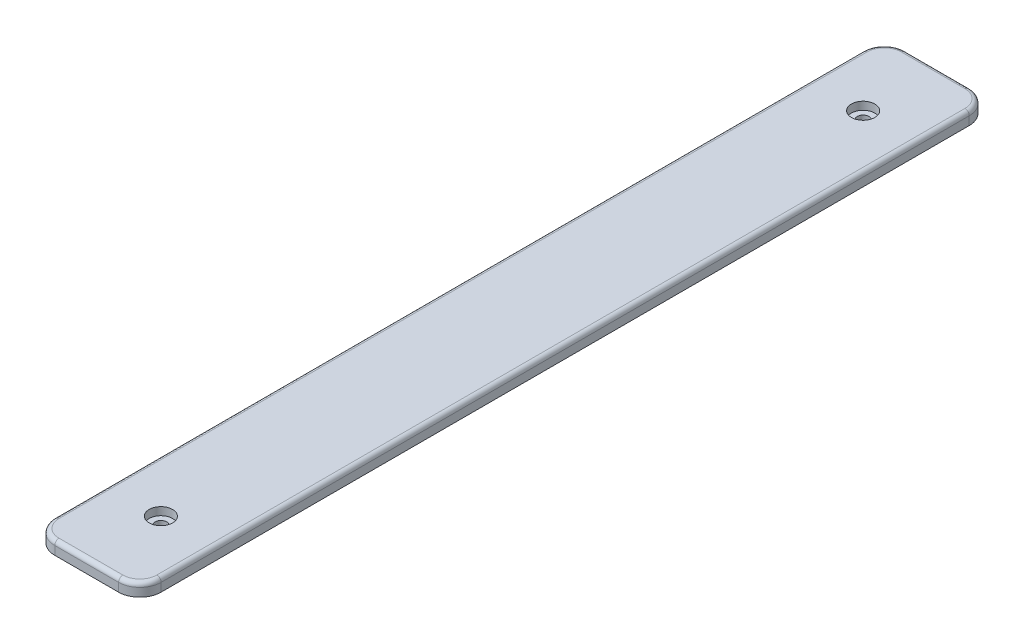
SolidWorks part; units mm, degrees
ref_plane "Front Plane" through (0, 0, 0) normal (0, 0, 1) x (1, 0, 0)
ref_plane "Top Plane" through (0, 0, 0) normal (0, 1, 0) x (1, 0, 0)
ref_plane "Right Plane" through (0, 0, 0) normal (1, 0, 0) x (0, 0, -1)
sketch "Sketch1" plane through (0, 0, 0) normal (0, 1, 0) x (1, 0, 0)
  line L0 (-25, -200) -> (25, 200) construction
  line L1 (-25, 200) -> (25, 200)
  line L2 (-25, 200) -> (-25, -200)
  line L3 (-25, -200) -> (25, -200)
  line L4 (25, 200) -> (25, -200)
  dimension "D1" = 400
  dimension "D2" = 50
extrude "Extrude1" add sketch "Sketch1" along normal blind 6
hole_wizard "CBORE for M5 Pan Head Machine Screw1" positions "Sketch3" profile "Sketch2" counterbore size "M5" standard "Ansi Metric"
sketch "Sketch3" plane through (0, 6, 0) normal (0, 1, 0) x (-1, 0, 0)
  line L0 (0, 200) -> (0, -200) construction
  line L1 (25, 200) -> (-25, 200) construction
  line L2 (-25, -200) -> (25, -200) construction
  line L3 (0, 0) -> (50.3155, 0) construction
  point P0 (0, 165.1)
  point P1 (0, -165.1)
  dimension "D1" = 330.2
sketch "Sketch2" plane through (0, 6, 165.1) normal (1, 0, 0) x (0, 0, 1)
  line L0 (0, 0) -> (0, 6)
  line L1 (0, 6) -> (2.75, 6)
  line L3 (2.75, 6) -> (2.75, 3.7)
  line L4 (2.75, 3.7) -> (5.5, 3.7)
  line L5 (5.5, 3.7) -> (5.5, 0)
  line L7 (5.5, 0) -> (0, 0)
  line L11 (0, -6.35) -> (0, 107.95) construction
  dimension "Thru Hole Dia." = 5.5
  dimension "Thru Hole Depth" = 6
  dimension "C'Bore Dia." = 11
  dimension "C'Bore Depth" = 3.7
fillet "Fillet1" radius 10 4 edges at (-25, 3, -200) (25, 3, -200) (25, 3, 200) (-25, 3, 200)
fillet "Fillet2" radius 2 8 edges at (-22.0711, 6, -197.0711) (0, 6, -200) (22.0711, 6, -197.0711) (25, 6, 0) (22.0711, 6, 197.0711) (0, 6, 200) (-22.0711, 6, 197.0711) (-25, 6, 0)
shell "Shell1" [suppressed] thickness 3
